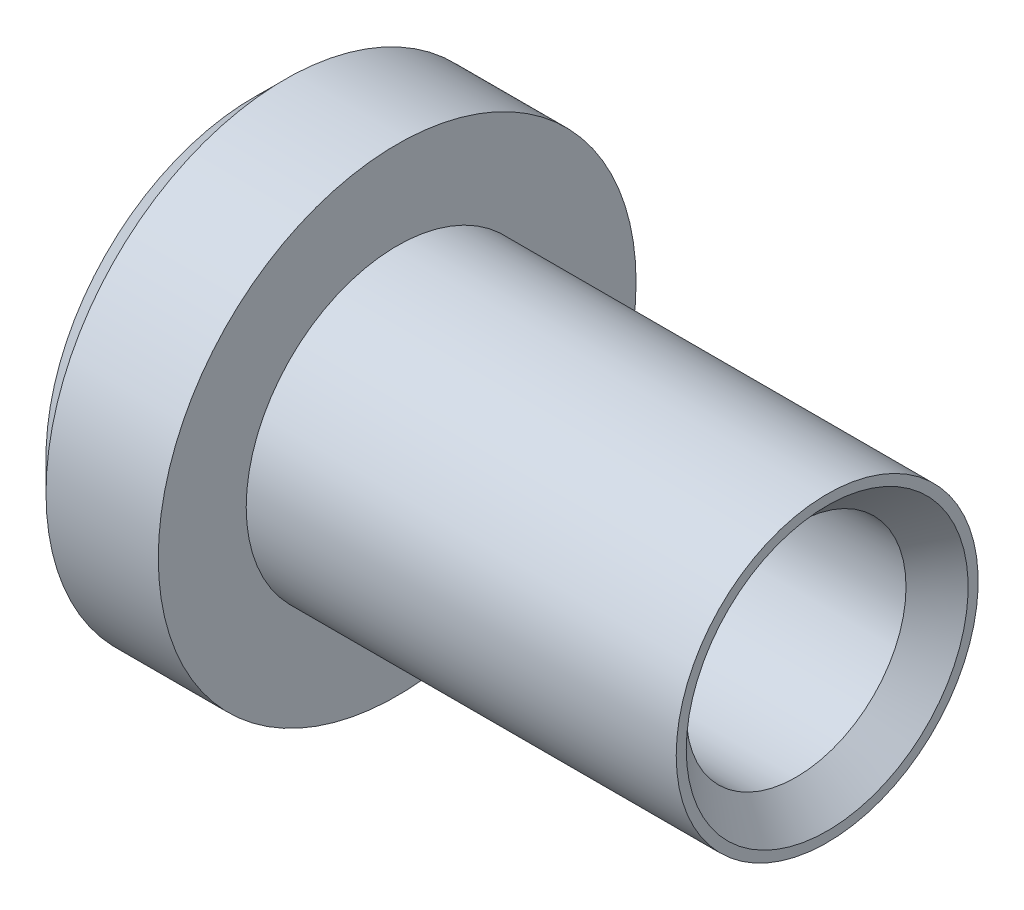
SolidWorks part; units mm, degrees
ref_plane "Front Plane" through (0, 0, 0) normal (0, 0, 1) x (1, 0, 0)
ref_plane "Top Plane" through (0, 0, 0) normal (0, 1, 0) x (1, 0, 0)
ref_plane "Right Plane" through (0, 0, 0) normal (1, 0, 0) x (0, 0, -1)
sketch "Sketch1" plane through (0, 0, 0) normal (0, 0, 1) x (1, 0, 0)
  line L0 (0, 0) -> (2.6899, 0)
  line L1 (0, 0) -> (0, 6.35)
  line L2 (0, 6.35) -> (3.81, 6.35)
  line L3 (3.81, 6.35) -> (3.81, 4.0132)
  line L4 (3.81, 4.0132) -> (15.24, 4.0132)
  line L5 (15.24, 4.0132) -> (15.24, 2.921)
  line L6 (15.24, 2.921) -> (4.445, 2.921)
  line L7 (0, 0) -> (20.2317, 0) construction
  line L8 (4.445, 2.921) -> (2.6899, 0)
  dimension "D1" = 6.35
  dimension "D2" = 3.81
  dimension "D3" = 2.921
  dimension "D4" = 4.0132
  dimension "D5" = 15.24
  dimension "D6" = 59
  dimension "D7" = 10.795
revolve "Revolve1" add sketch "Sketch1" angle 360 about L7
chamfer "Chamfer1" distance 0.8255 angle 45 2 edges at (15.24, 0, 2.921) (0, 0, 6.35)
